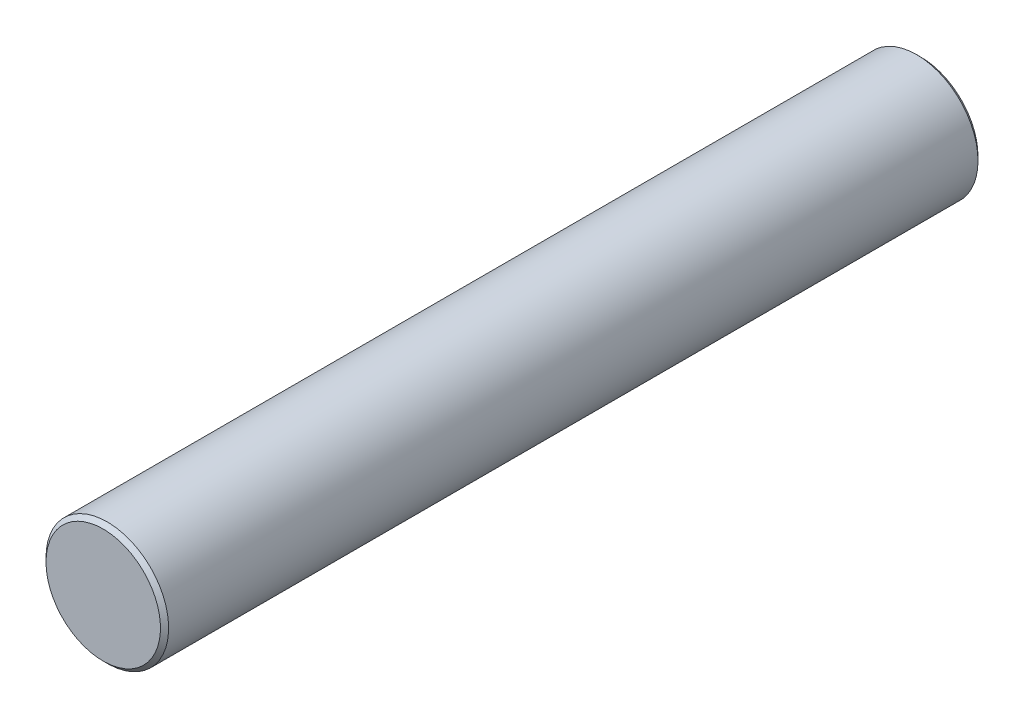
SolidWorks part; units mm, degrees
ref_plane "Face" through (0, 0, 0) normal (0, 0, 1) x (1, 0, 0)
ref_plane "Dessus" through (0, 0, 0) normal (0, 1, 0) x (1, 0, 0)
ref_plane "Droite" through (0, 0, 0) normal (1, 0, 0) x (0, 0, -1)
sketch "Esquisse1" plane through (0, 0, 0) normal (0, 0, 1) x (1, 0, 0)
  circle A0 centre (0, 0) radius 1.5
  dimension "D1" = 3
extrude "Cylindre de base" add sketch "Esquisse1" along normal mid plane 20
chamfer "Chanfrein1" distance 0.1 angle 45
